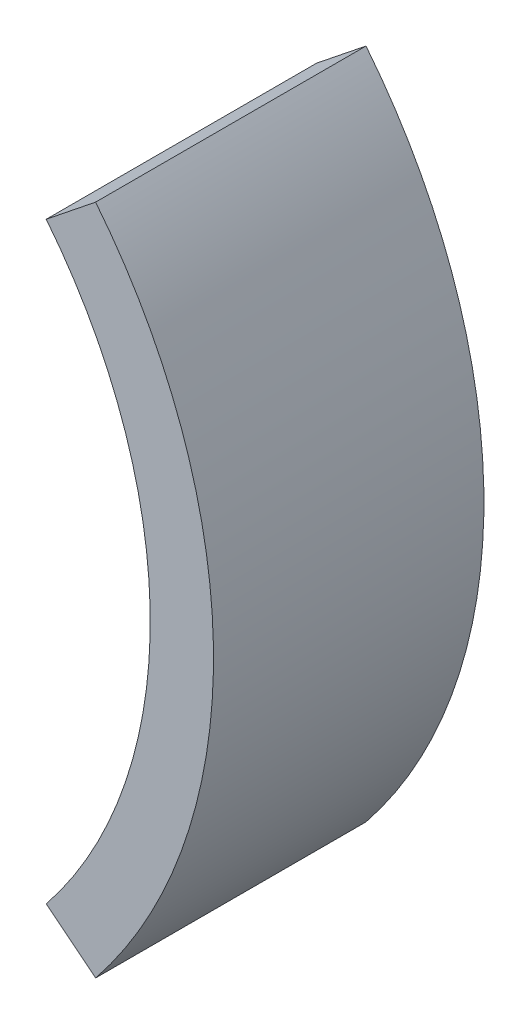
SolidWorks part; units mm, degrees
ref_plane "Front Plane" through (0, 0, 0) normal (0, 0, 1) x (1, 0, 0)
ref_plane "Top Plane" through (0, 0, 0) normal (0, 1, 0) x (1, 0, 0)
ref_plane "Right Plane" through (0, 0, 0) normal (1, 0, 0) x (0, 0, -1)
sketch "Sketch1" plane through (0, 0, 0) normal (0, 0, 1) x (1, 0, 0)
  line L0 (0, 0) -> (30, 0) construction
  arc A0 (23.4212, 18.7469) -> (23.4212, -18.7469) centre (0, 0) cw
  dimension "D1" = 30
  dimension "D2" = 40.5
extrude "Extrude-Thin1" add sketch "Sketch1" along normal mid plane 17.1 thin
